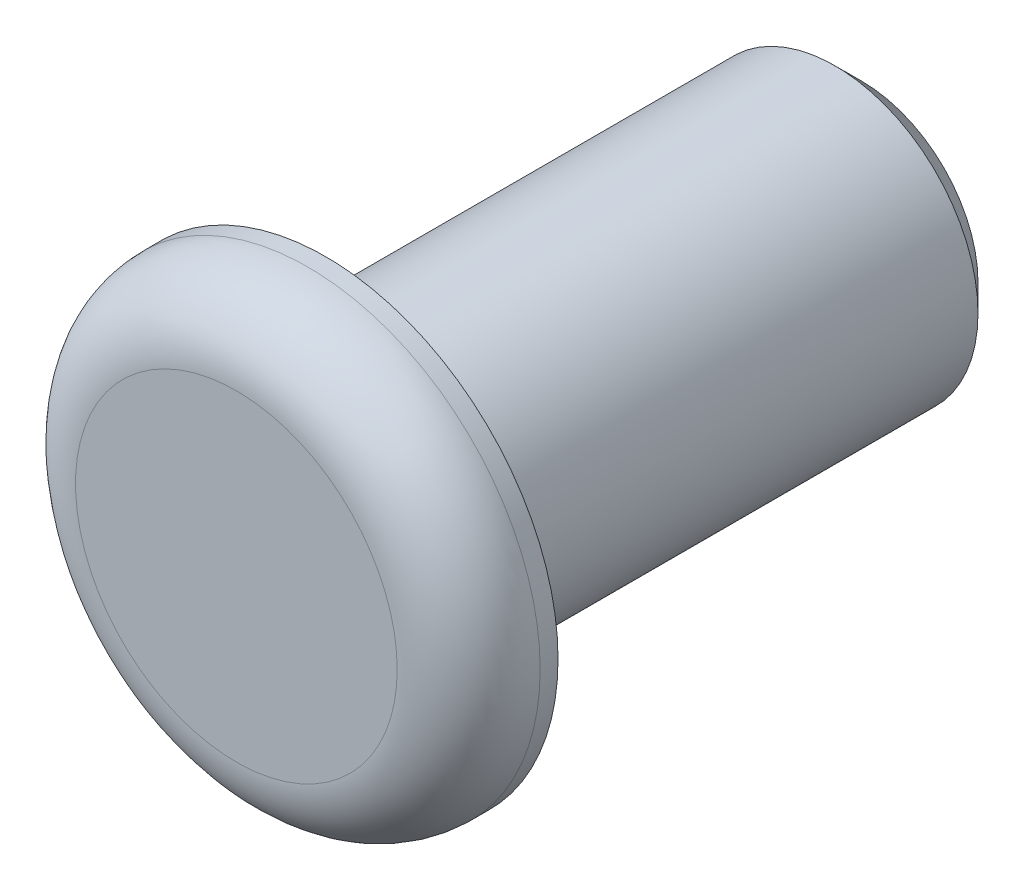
SolidWorks part; units mm, degrees
ref_plane "Front Plane" through (0, 0, 0) normal (0, 0, 1) x (1, 0, 0)
ref_plane "Top Plane" through (0, 0, 0) normal (0, 1, 0) x (1, 0, 0)
ref_plane "Right Plane" through (0, 0, 0) normal (1, 0, 0) x (0, 0, -1)
sketch "Sketch1" plane through (0, 0, 0) normal (0, 0, 1) x (1, 0, 0)
  circle A0 centre (0, 0) radius 6.5
  dimension "D1" = 13
extrude "Boss-Extrude1" add sketch "Sketch1" along normal blind 2.5
sketch "Sketch2" plane through (0, 0, 0) normal (0, 0, -1) x (-1, 0, 0)
  circle A0 centre (0, 0) radius 4
  dimension "D1" = 8
extrude "Boss-Extrude2" add sketch "Sketch2" along normal blind 15
chamfer "Chamfer1" distance 0.75 angle 45 1 edges at (-4, 0, -15)
fillet "Fillet1" radius 2 1 edges at (6.5, 0, 2.5)
